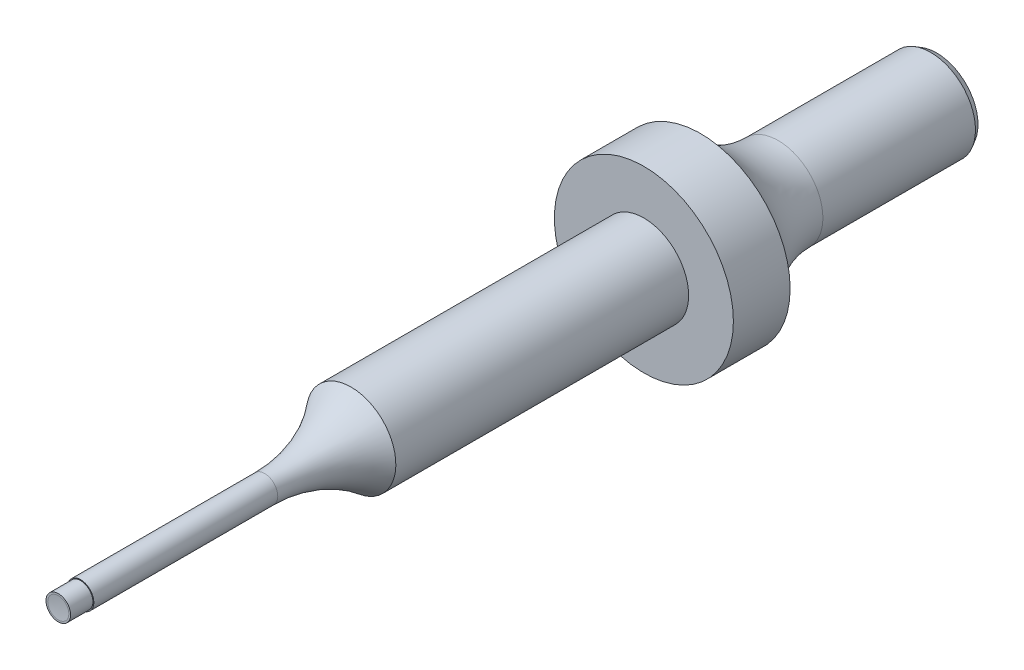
SolidWorks part; units mm, degrees
ref_plane "Front Plane" through (0, 0, 0) normal (0, 0, 1) x (1, 0, 0)
ref_plane "Top Plane" through (0, 0, 0) normal (0, 1, 0) x (1, 0, 0)
ref_plane "Right Plane" through (0, 0, 0) normal (1, 0, 0) x (0, 0, -1)
sketch "Sketch1" plane through (0, 0, 0) normal (0, 0, 1) x (1, 0, 0)
  circle A0 centre (0, 0) radius 5.095
  dimension "D1" = 10.19
extrude "Boss-Extrude1" add sketch "Sketch1" against normal blind 100
sketch "Sketch2" plane through (0, 0, 0) normal (0, 0, 1) x (1, 0, 0)
  circle A0 centre (0, 0) radius 1.5
  dimension "D1" = 3
extrude "Cut-Extrude1" cut sketch "Sketch2" against normal blind 33.3333 flip side to cut
sketch "Sketch3" plane through (0, 0, 0) normal (0, 0, 1) x (1, 0, 0)
  circle A0 centre (0, 0) radius 1.4
  dimension "D1" = 2.8
extrude "Cut-Extrude2" cut sketch "Sketch3" against normal blind 2.5475 flip side to cut
sketch "Sketch4" plane through (0, 0, 0) normal (1, 0, 0) x (0, 0, -1)
  line L0 (0, 0) -> (0, 1.2)
  line L1 (0, 1.4) -> (0, -1.4) construction
  line L2 (0.0709, 0) -> (0.0709, 1.2) construction
  line L3 (0, 0) -> (0.0709, 0)
  line L4 (0, 0) -> (0, -1.2) construction
  arc A0 (0.0709, 0) -> (0, 1.2) centre (-10.1191, 0) ccw
  dimension "D2" = 10.19
  dimension "D1" = 2.4
revolve "Cut-Revolve1" cut sketch "Sketch4" angle 360 about L3
chamfer "Chamfer1" distance 0.6793 angle 30 1 edges at (5.095, 0, -100)
sketch "Sketch5" plane through (0, 0, 0) normal (1, 0, 0) x (0, 0, -1)
  line L0 (33.3333, 0) -> (23.4857, 0)
  line L1 (33.3333, 5.095) -> (33.3333, -5.095) construction
  line L2 (23.4857, 0) -> (23.4857, 1.5)
  line L3 (33.3333, 1.5) -> (2.5475, 1.5) construction
  line L4 (33.3333, 5.095) -> (33.3333, 0)
  line L5 (23.4857, 1.5) -> (33.3333, 1.5) construction
  arc A0 (23.4857, 1.5) -> (33.3333, 5.095) centre (23.4857, 16.785) ccw
  dimension "D1" = 15.285
revolve "Revolve1" add sketch "Sketch5" angle 360 about L0
sketch "Sketch6" plane through (0, 0, 0) normal (1, 0, 0) x (0, 0, -1)
  line L0 (66.6667, 0) -> (81.9517, 0)
  line L1 (66.6667, 0) -> (66.6667, 10.19)
  line L2 (66.6667, 10.19) -> (73.1269, 10.19)
  line L3 (81.9517, 0) -> (81.9517, 5.095)
  line L4 (99.3207, 5.095) -> (33.3333, 5.095) construction
  line L5 (81.9517, 5.095) -> (66.6667, 5.095) construction
  line L6 (100, -5.095) -> (100, 5.095) construction
  arc A0 (81.9517, 5.095) -> (73.1269, 10.19) centre (81.9517, 15.285) cw
  dimension "D2" = 10.19
  dimension "D1" = 33.3333
  dimension "D3" = 15.285
revolve "Revolve2" add sketch "Sketch6" angle 360 about L0
sketch "Sketch7" plane through (0, 0, -100) normal (0, 0, -1) x (-1, 0, 0)
  line L9 (-8.6234, 1.9603) -> (-4.7028, 1.9603)
  line L10 (-8.6234, 1.9603) -> (-8.6234, -1.9603)
  line L11 (-8.6234, -1.9603) -> (-4.7028, -1.9603)
  line L12 (-4.7028, 1.9603) -> (-4.7028, -1.9603)
  circle A5 centre (0, 0) radius 5.095 construction
  circle A6 centre (0, 0) radius 4.7028 construction
  point P8 (-4.7028, 0)
extrude "Cut-Extrude3" [suppressed] cut sketch "Sketch7" against normal through all
